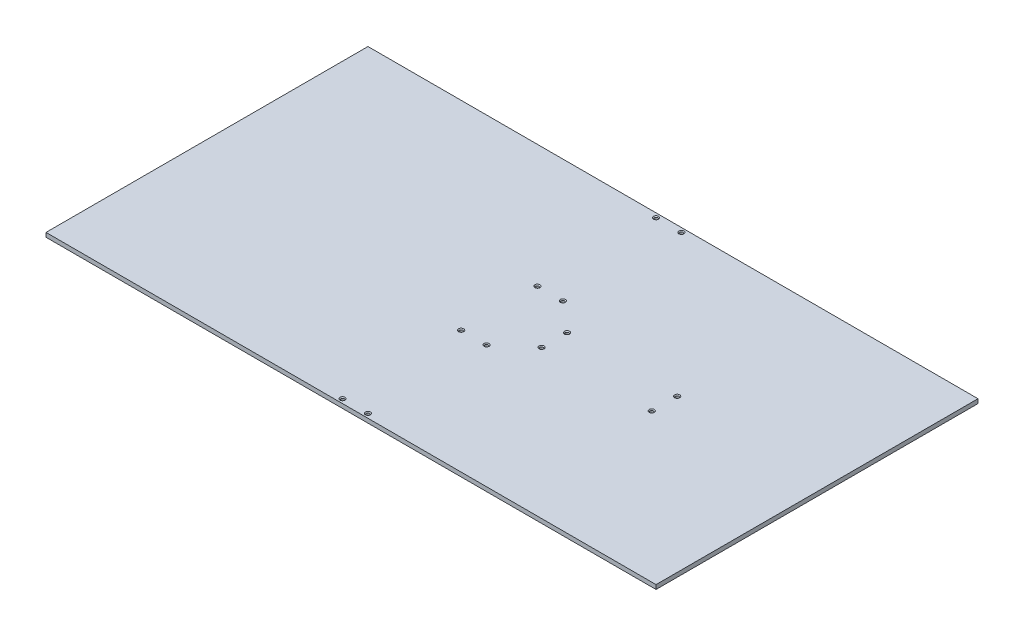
SolidWorks part; units mm, degrees
ref_plane "Front Plane" through (0, 0, 0) normal (0, 0, 1) x (1, 0, 0)
ref_plane "Top Plane" through (0, 0, 0) normal (0, 1, 0) x (1, 0, 0)
ref_plane "Right Plane" through (0, 0, 0) normal (1, 0, 0) x (0, 0, -1)
sketch "Sketch2" plane through (0, 0, 0) normal (0, 1, 0) x (1, 0, 0)
  line L1 (0, 0) -> (914.4, 0)
  line L2 (0, 0) -> (0, 482.6)
  line L3 (0, 482.6) -> (914.4, 482.6)
  line L4 (914.4, 0) -> (914.4, 482.6)
  dimension "D1" = 482.6
  dimension "D2" = 914.4
extrude "Boss-Extrude1" add sketch "Sketch2" along normal blind 6.35
sketch "Sketch3" plane through (0, 6.35, 0) normal (0, 1, 0) x (1, 0, 0)
  line L0 (457.2, 482.6) -> (457.2, 0)
  line L1 (914.4, 482.6) -> (0, 482.6) construction
  line L2 (0, 0) -> (914.4, 0) construction
  line L3 (457.2, 241.3) -> (914.4, 241.3)
  line L4 (914.4, 0) -> (914.4, 482.6) construction
  line L5 (914.4, 241.3) -> (0, 241.3)
  line L6 (0, 482.6) -> (0, 0) construction
  line L7 (457.2, 482.6) -> (457.2, 241.3)
  line L8 (457.2, 482.6) -> (476.25, 482.6)
  line L9 (457.2, 482.6) -> (438.15, 482.6)
  line L10 (438.15, 482.6) -> (438.15, 298.45)
  line L11 (476.25, 482.6) -> (476.25, 298.45)
  line L12 (457.2, 0) -> (476.25, 0)
  line L13 (476.25, 0) -> (438.15, 0)
  line L14 (438.15, 0) -> (438.15, 184.15)
  line L15 (476.25, 0) -> (476.25, 184.15)
  line L17 (457.2, 241.3) -> (520.7, 241.3)
  line L19 (520.7, 241.3) -> (520.7, 260.35)
  line L21 (520.7, 241.3) -> (520.7, 222.25)
  line L23 (438.15, 482.6) -> (438.15, 476.25)
  line L25 (476.25, 482.6) -> (476.25, 476.25)
  line L27 (438.15, 0) -> (438.15, 6.35)
  line L29 (476.25, 0) -> (476.25, 6.35)
  line L31 (685.8, 241.3) -> (685.8, 260.35)
  line L32 (685.8, 260.35) -> (685.8, 222.25)
  point P16 (438.15, 298.45)
  point P17 (476.25, 298.45)
  point P20 (438.15, 184.15)
  point P21 (476.25, 184.15)
  point P39 (520.7, 260.35)
  point P44 (520.7, 222.25)
  point P54 (438.15, 476.25)
  point P59 (476.25, 476.25)
  point P64 (438.15, 6.35)
  point P69 (476.25, 6.35)
  point P73 (685.8, 260.35)
  point P75 (685.8, 222.25)
  dimension "D1" = 19.05
  dimension "D2" = 19.05
  dimension "D3" = 184.15
  dimension "D4" = 184.15
  dimension "D5" = 184.15
  dimension "D6" = 184.15
  dimension "D7" = 63.5
  dimension "D8" = 19.05
  dimension "D9" = 19.05
  dimension "D10" = 6.35
  dimension "D11" = 6.35
  dimension "D12" = 6.35
  dimension "D13" = 6.35
hole_wizard "1/4-20 Tapped Hole1" positions "Sketch3" profile "Sketch4" tap size "1/4-20" standard "ANSI Inch"
sketch "Sketch4" plane through (685.8, 6.35, -222.25) normal (1, 0, 0) x (0, 0, 1)
  line L0 (0, 0) -> (0, 6.35)
  line L1 (0, 6.35) -> (2.5527, 6.35)
  line L2 (2.5527, 6.35) -> (2.5527, 1.2573)
  line L3 (2.5527, 1.2573) -> (3.81, 0)
  line L5 (3.81, 0) -> (0, 0)
  line L6 (-2.5527, 1.2573) -> (-3.81, 0) construction
  line L11 (0, -6.35) -> (0, 107.95) construction
  dimension "Thru Tap Drill Dia." = 5.1054
  dimension "Thru Tap Drill Depth" = 6.35
  dimension "Near C'Sink Dia." = 7.62
  dimension "Near C'Sink Angle" = 90
